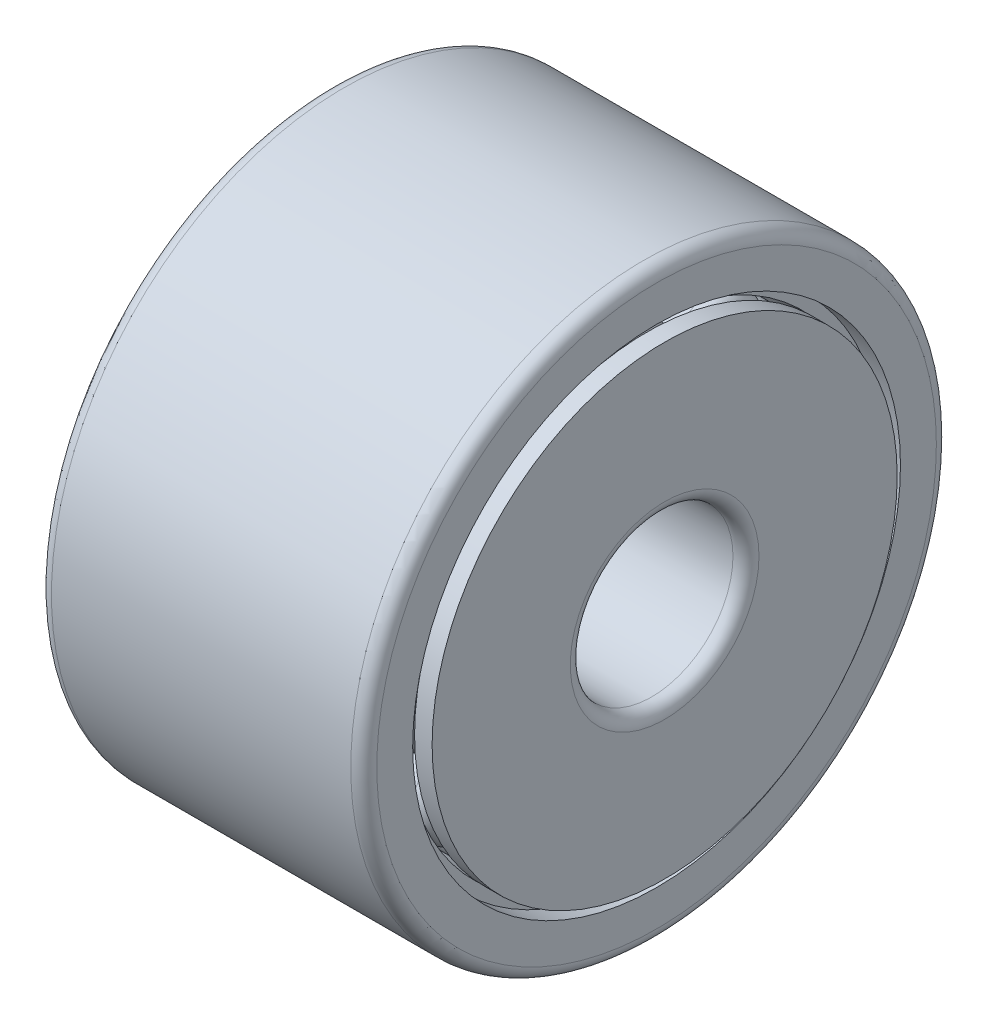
SolidWorks part; units mm, degrees
ref_plane "Plane1" through (0, 0, 0) normal (0, 0, 1) x (1, 0, 0)
ref_plane "Plane2" through (0, 0, 0) normal (0, 1, 0) x (1, 0, 0)
ref_plane "Plane3" through (0, 0, 0) normal (1, 0, 0) x (0, 0, -1)
other "Configuration Table"
sketch "Clipboard" plane through (0, 0, 0) normal (0, 0, 1) x (1, 0, 0)
  line L0 (-10, 0) -> (10, 0) construction
  line L1 (0, 0) -> (27.0344, -5.7463)
  line L2 (0, 0) -> (22.4793, 28.7722)
  line L3 (0, 0) -> (27.9428, -35.7651)
  line L4 (0, 0) -> (-22.3471, -0.7804)
sketch "OutRacSke" plane through (0, 0, 0) normal (0, 0, 1) x (1, 0, 0)
  line L0 (-14.0229, 22.6933) -> (-14.0229, 23.8026)
  line L1 (-14.0229, 23.8026) -> (-15.875, 23.8026)
  line L2 (-15.875, 23.8026) -> (-15.875, 27.305)
  line L3 (-14.605, 28.575) -> (14.605, 28.575)
  line L4 (15.875, 27.305) -> (15.875, 23.8026)
  line L5 (15.875, 23.8026) -> (14.0229, 23.8026)
  line L6 (14.0229, 23.8026) -> (14.0229, 22.6933)
  line L7 (14.0229, 22.6933) -> (-14.0229, 22.6933)
  line L8 (-7.9375, 0) -> (7.9375, 0) construction
  arc A0 (-15.875, 27.305) -> (-14.605, 28.575) centre (-14.605, 27.305) cw
  arc A1 (14.605, 28.575) -> (15.875, 27.305) centre (14.605, 27.305) cw
revolve "OuterRace" add sketch "OutRacSke" angle 360 about L8
sketch "RolDetSke" plane through (0, 0, 0) normal (0, 0, 1) x (1, 0, 0)
  line L0 (-14.0229, 20.9261) -> (-14.0229, 18.2562)
  line L1 (-14.0229, 18.2562) -> (14.0229, 18.2563)
  line L2 (14.0229, 18.2563) -> (14.0229, 20.9261)
  line L3 (12.243, 22.706) -> (-12.243, 22.706)
  line L4 (-28.575, 18.2562) -> (28.575, 18.2562) construction
  arc A0 (14.0229, 20.9261) -> (12.243, 22.706) centre (12.243, 20.9261) ccw
  arc A1 (-12.243, 22.706) -> (-14.0229, 20.9261) centre (-12.243, 20.9261) ccw
revolve "RollerDetailed" add sketch "RolDetSke" angle 360 about L4
ref_axis "Axis1" through (-50, 0, 0) along (1, 0, 0)
pattern_circular "RollersDetailed" count 12 every 30 about axis through (-50, 0, 0) along (1, 0, 0) of "RollerDetailed"
sketch "RolSimSke" plane through (0, 25.4, 0) normal (0, 0, 1) x (1, 0, 0)
  line L0 (-14.0229, -4.4612) -> (-14.0229, -9.8009)
  line L1 (-25.4, -25.4) -> (25.4, -25.4) construction
  line L2 (14.0229, -9.8009) -> (14.0229, -4.4612)
  line L3 (12.243, -2.6813) -> (-12.243, -2.6813)
  line L5 (12.243, -11.5808) -> (-12.243, -11.5808)
  arc A0 (14.0229, -4.4612) -> (12.243, -2.6813) centre (12.243, -4.4612) ccw
  arc A1 (-12.243, -2.6813) -> (-14.0229, -4.4612) centre (-12.243, -4.4612) ccw
  arc A2 (14.0229, -9.8009) -> (12.243, -11.5808) centre (12.243, -9.8009) cw
  arc A3 (-12.243, -11.5808) -> (-14.0229, -9.8009) centre (-12.243, -9.8009) cw
revolve "RollersSimplified" [suppressed] add sketch "RolSimSke" angle 360 about L1
sketch "InsRacSke" plane through (0, 0, 0) normal (0, 0, 1) x (1, 0, 0)
  line L0 (-14.949, 13.8192) -> (-14.949, 22.6933)
  line L1 (-14.949, 22.6933) -> (-16.6624, 22.6933)
  line L2 (-16.6624, 22.6933) -> (-16.6624, 9.2075)
  line L3 (-15.3924, 7.9375) -> (-0.84, 7.9375)
  line L4 (0.84, 7.9375) -> (15.3924, 7.9375)
  line L5 (16.6624, 9.2075) -> (16.6624, 22.6933)
  line L6 (16.6624, 22.6933) -> (14.949, 22.6933)
  line L7 (14.949, 22.6933) -> (14.949, 13.8192)
  line L8 (14.949, 13.8192) -> (-14.949, 13.8192)
  line L9 (-7.9375, 0) -> (7.9375, 0) construction
  arc A0 (-16.6624, 9.2075) -> (-15.3924, 7.9375) centre (-15.3924, 9.2075) ccw
  arc A1 (-0.84, 7.9375) -> (0.84, 7.9375) centre (0, 6.985) cw
  arc A2 (15.3924, 7.9375) -> (16.6624, 9.2075) centre (15.3924, 9.2075) ccw
revolve "InnerRace" add sketch "InsRacSke" angle 360 about L9
equation "\"halfWidth@OutRacSke\" =  \"Width@OutRacSke\" / 2"
equation "\"CLdia@Clipboard\" =  ( \"Race_OD@Clipboard\" + \"Race_ID@Clipboard\" )  / 2"
equation "\"CLRad@RolDetSke\" = ( \"Race_OD@Clipboard\" + \"Race_ID@Clipboard\" )  / 4"
equation "\"Roller_diameter@RolDetSke\" =  ( \"Race_OD@Clipboard\" -  \"Race_ID@Clipboard\" )  / 2 + .001"
equation "\"Roller_diameter@RolSimSke\" = ( \"Race_OD@Clipboard\" -  \"Race_ID@Clipboard\" )  / 2 + .001"
equation "\"radius@RolDetSke\" = \"Roller_diameter@RolDetSke\" / 5"
equation "\"radius@RolSimSke\" = \"Roller_diameter@RolSimSke\" / 5"
equation "\"Cyl_Len@OutRacSke\" = \"Cyl_Len@RolDetSke\""
equation "\"Cyl_Len@RolSimSke\" = \"Cyl_Len@RolDetSke\""
equation "\"halfCylLen@RolDetSke\" = \"Cyl_Len@RolDetSke\" / 2"
equation "\"offset@InsRacSke\" = \"radius@InsRacSke\" * 0.75"
equation "\"SlotWidth@InsRacSke\" =  ( \"Width@OutRacSke\" + \"Cyl_Len@RolDetSke\" )  / 2"
equation "\"halfSlotWidth@InsRacSke\" = \"SlotWidth@InsRacSke\" / 2"
equation "\"D1@OutRacSke\" = \"Cyl_Len@OutRacSke\" / 2"
equation "\"Max_count@Clipboard\" = int( 3.14159265 / atn(( \"Roller_diameter@RolDetSke\" / 2) / sqr( \"CLRad@RolDetSke\"  *  \"CLRad@RolDetSke\" - ( \"Roller_diameter@RolDetSke\" / 2) *  ( \"Roller_diameter@RolDetSke\" / "
equation "\"Max_count@Clipboard\" = ((sgn( \"Max_count@Clipboard\" - \"Count@Clipboard\" )-1)*( \"Max_count@Clipboard\" - \"Count@Clipboard\" ))/-2+ \"Count@Clipboard\""
equation "\"Count@RollersDetailed\" = int( \"Show_count@Clipboard\" ) "
equation "\"Count@RollersDetailed\" = ((sgn( \"Count@RollersDetailed\" - \"Max_count@Clipboard\" )-1)*( \"Count@RollersDetailed\" - \"Max_count@Clipboard\" ))/-2+ \"Max_count@Clipboard\""
equation "\"Count@RollersDetailed\" = ((sgn( \"Count@RollersDetailed\" - \"Min_count@Clipboard\" )+1)*( \"Count@RollersDetailed\" - \"Min_count@Clipboard\"))/2 +\"Min_count@Clipboard\""
equation "\"Angle@RollersDetailed\" = 360.0 / \"Max_count@Clipboard\""
equation "\"Bore@RolSimSke\" = \"Race_ID@Clipboard\""
equation "\"Race_ID@InsRacSke\" = \"Race_ID@Clipboard\""
equation "\"Race_OD@InsRacSke\" = \"Race_OD@Clipboard\""
equation "\"halfWidth@InsRacSke\" = \"Width_IR@InsRacSke\" / 2"
equation "\"halfLength@RolSimSke\" = \"Cyl_Len@RolSimSke\" / 2"
equation "\"Race_OD@OutRacSke\" = \"Race_OD@Clipboard\""
